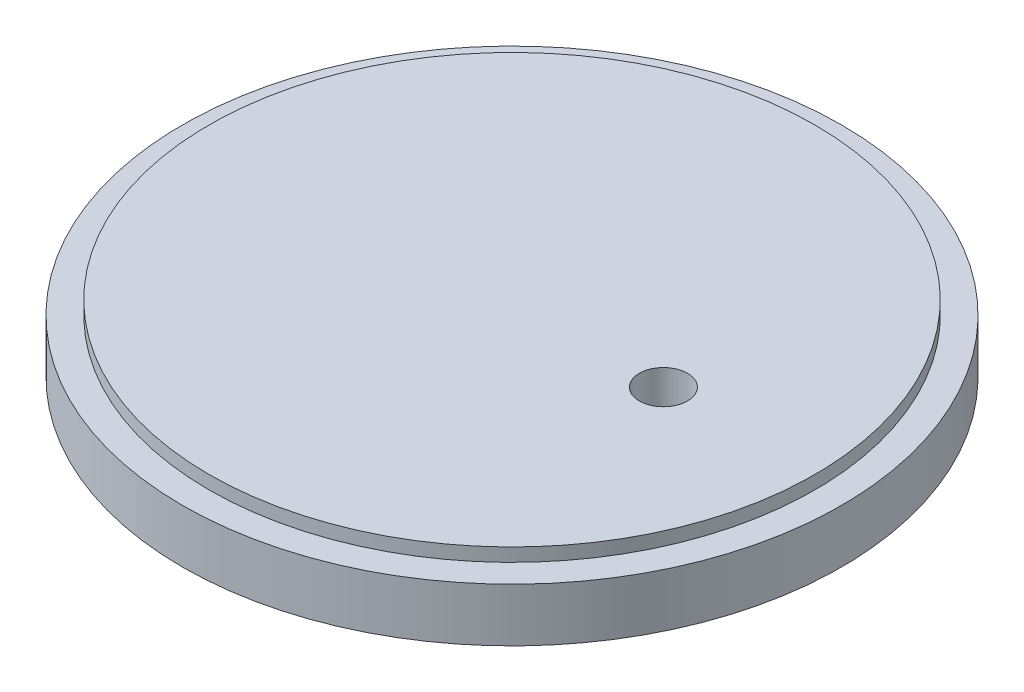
SolidWorks part; units mm, degrees
ref_plane "Plan de face" through (0, 0, 0) normal (0, 0, 1) x (1, 0, 0)
ref_plane "Plan de dessus" through (0, 0, 0) normal (0, 1, 0) x (1, 0, 0)
ref_plane "Plan de droite" through (0, 0, 0) normal (1, 0, 0) x (0, 0, -1)
sketch "Esquisse1" plane through (0, 0, 0) normal (0, 0, 1) x (1, 0, 0)
  line L0 (0, -57.08) -> (0, 58.9086) construction
  line L1 (-67.007, 0) -> (51.8553, 0) construction
  line L2 (0, -3.75) -> (37, -3.75)
  line L3 (37, -3.75) -> (37, 2.25)
  line L4 (37, 2.25) -> (34, 2.25)
  line L5 (34, 2.25) -> (34, 3.75)
  line L6 (34, 3.75) -> (0, 3.75)
  line L7 (0, -3.75) -> (0, 3.75)
  dimension "D1" = 1.5
  dimension "D2" = 7.5
  dimension "D3" = 37
  dimension "D4" = 34
revolve "Révolution1" add sketch "Esquisse1" angle 360 about L0
hole_wizard "Perçage1" positions "Esquisse3" profile "Esquisse2" legacy
sketch "Esquisse3" plane through (0, -3.75, 0) normal (0, -1, 0) x (1, 0, 0)
  line L1 (46.3151, 0) -> (-45.3311, 0) construction
  line L5 (0, 28.1826) -> (0, -33.2428) construction
  line L7 (17, 22.9818) -> (17, -18.765) construction
  point P0 (17, 0)
  dimension "D1" = 17
sketch "Esquisse2" plane through (17, -3.75, 0) normal (1, 0, 0) x (0, 0, -1)
  line L0 (0, 0) -> (0, 9.1223)
  line L1 (0, 9.1223) -> (2.7, 7.5)
  line L2 (2.7, 7.5) -> (2.7, 2.6458)
  line L3 (2.7, 2.6458) -> (5, 0)
  line L4 (5, 0) -> (0, 0)
  line L5 (0, -14.3089) -> (0, 102.4216) construction
  line L6 (0, 9.1223) -> (-2.7, 7.5) construction
  line L7 (-2.7, 2.6458) -> (-5, 0) construction
  dimension "Diamètre" = 5.4
  dimension "Profondeur" = 7.5
  dimension "Diamètre fraisé" = 10
  dimension "Angle fraisé" = 82
  dimension "Angle" = 118
